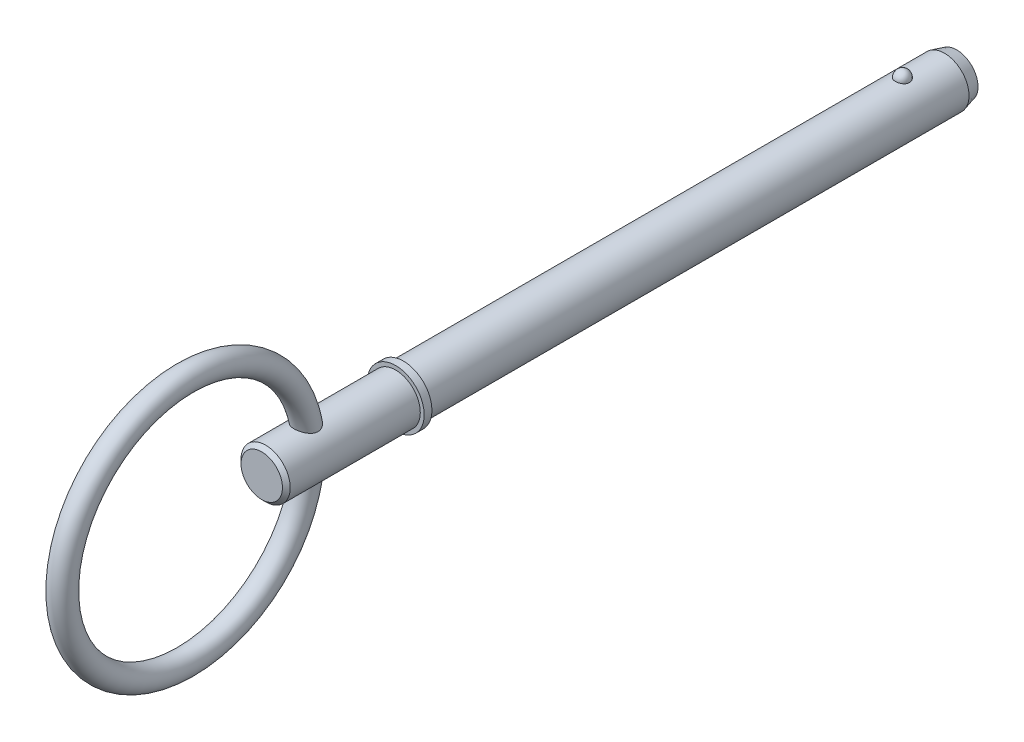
SolidWorks part; units mm, degrees
ref_plane "Front Plane" through (0, 0, 0) normal (0, 0, 1) x (1, 0, 0)
ref_plane "Top Plane" through (0, 0, 0) normal (0, 1, 0) x (1, 0, 0)
ref_plane "Right Plane" through (0, 0, 0) normal (1, 0, 0) x (0, 0, -1)
sketch "Sketch2" plane through (0, 0, 0) normal (0, 0, 1) x (1, 0, 0)
  circle A0 centre (0, 0) radius 3.175
  point P3 (0, 3.175)
  dimension "D1" = 6.35
extrude "Boss-Extrude1" add sketch "Sketch2" along normal blind 63.5
sketch "Sketch3" plane through (0, 0, 0) normal (0, 0, -1) x (-1, 0, 0)
  circle A0 centre (0, 0) radius 3.175
  dimension "D1" = 6.35
extrude "Boss-Extrude2" add sketch "Sketch3" along normal blind 7.92
chamfer "Chamfer1" distance 1.586 angle 15 1 edges at (-3.175, 0, -7.92)
sketch "Sketch18" plane through (0, 0, 0) normal (1, 0, 0) x (0, 0, -1)
  line L0 (6.334, 3.175) -> (-63.5, 3.175) construction
  line L1 (0.91, 4.085) -> (0.91, 2.265)
  line L2 (-63.5, -3.175) -> (6.334, -3.175) construction
  arc A0 (0.91, 4.085) -> (0.91, 2.265) centre (0.91, 3.175) ccw
  point P4 (0, 3.175)
  dimension "D1" = 7.26
revolve "Revolve1" add sketch "Sketch18" angle 360 about L1
sketch "Sketch19" plane through (0, 0, 0) normal (1, 0, 0) x (0, 0, -1)
  line L0 (-33.7288, 0) -> (-46.4542, 0) construction
sketch "Sketch20" plane through (0, 0, 0) normal (1, 0, 0) x (0, 0, -1)
  line L0 (-63.5, 0) -> (-63.5, 3.675)
  line L1 (-63.5, 3.175) -> (-63.5, -3.175) construction
  line L2 (-63.5, 3.675) -> (-64.5, 3.675)
  line L3 (-64.5, 3.675) -> (-64.5, 0)
  line L4 (-33.7288, 0) -> (-46.4542, 0) construction
  line L5 (-64.5, 0) -> (-63.5, 0)
  dimension "D1" = 3.675
  dimension "D2" = 1
revolve "Revolve2" add sketch "Sketch20" angle 360 about L0
sketch "Sketch21" plane through (0, 0, 63.5) normal (0, 0, -1) x (-1, 0, 0)
  circle A0 centre (0, 0) radius 3.175
  dimension "D1" = 6.35
extrude "Boss-Extrude3" add sketch "Sketch21" against normal blind 18.29
chamfer "Chamfer2" distance 0.5 angle 45 1 edges at (-3.175, 0, 81.79)
sketch "Sketch23" plane through (0, 0, 0) normal (1, 0, 0) x (0, 0, -1)
  line L0 (-81.79, 2.675) -> (-81.79, -2.675) construction
  circle A0 centre (-91.665, 0) radius 15.875
  point P2 (-75.79, 0)
  dimension "D1" = 31.75
  dimension "D2" = 6
sketch "Sketch24" plane through (0, 0, 0) normal (0, 1, 0) x (1, 0, 0)
  circle A0 centre (0, -75.79) radius 1.5
  dimension "D1" = 3
sweep "Sweep1" add profiles "Sketch24" path "Sketch23"
